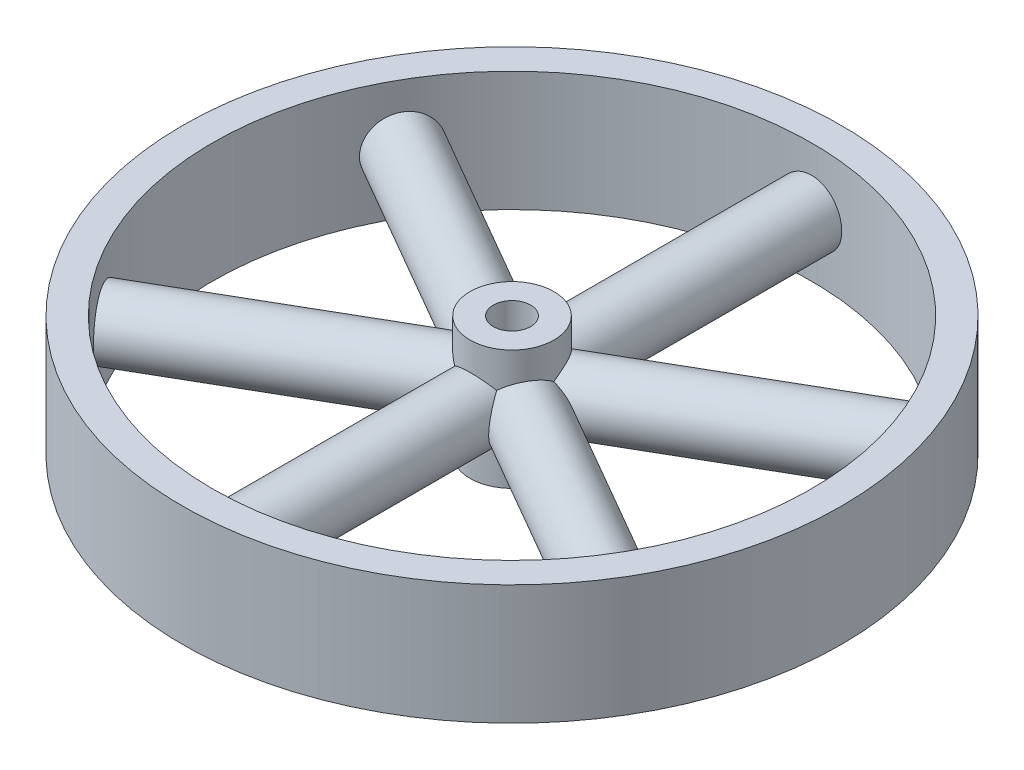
SolidWorks part; units mm, degrees
ref_plane "Front Plane" through (0, 0, 0) normal (0, 0, 1) x (1, 0, 0)
ref_plane "Top Plane" through (0, 0, 0) normal (0, 1, 0) x (1, 0, 0)
ref_plane "Right Plane" through (0, 0, 0) normal (1, 0, 0) x (0, 0, -1)
sketch "Sketch1" plane through (0, 0, 0) normal (0, 1, 0) x (1, 0, 0)
  circle A0 centre (0, 0) radius 63.5
  dimension "D1" = 127
extrude "Extrude-Thin1" add sketch "Sketch1" along normal mid plane 25.4 thin
sketch "Sketch2" plane through (0, 0, 0) normal (0, 1, 0) x (1, 0, 0)
  circle A0 centre (0, 0) radius 8.8951
sketch "Sketch3" plane through (0, 0, 0) normal (0, 0, 1) x (1, 0, 0)
  circle A0 centre (0, 0) radius 6.7451
extrude "Extrude2" add sketch "Sketch2" along normal mid plane 25.4
extrude "Extrude3" add sketch "Sketch3" along normal up to surface (63.1407 mm away)
pattern_circular "CirPattern2" count 6 over 360 about axis through (0, 12.7, 0) along (0, -1, 0) of "Extrude3"
sketch "Sketch4" plane through (0, 12.7, 0) normal (0, 1, 0) x (-1, 0, 0)
  circle A0 centre (0, 0) radius 3.9617
extrude "Cut-Extrude1" cut sketch "Sketch4" against normal through all
